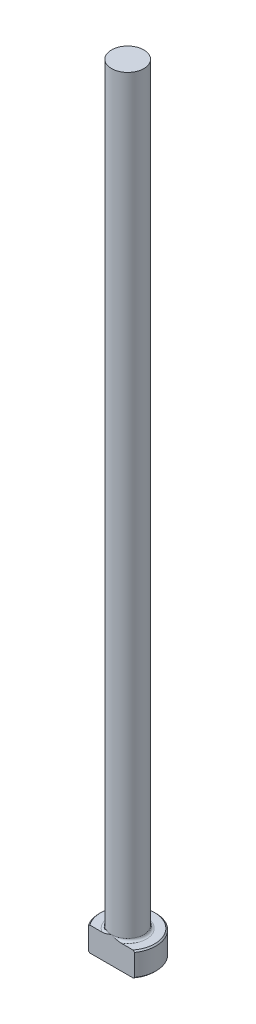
SolidWorks part; units mm, degrees
ref_plane "Front Plane" through (0, 0, 0) normal (0, 0, 1) x (1, 0, 0)
ref_plane "Top Plane" through (0, 0, 0) normal (0, 1, 0) x (1, 0, 0)
ref_plane "Right Plane" through (0, 0, 0) normal (1, 0, 0) x (0, 0, -1)
sketch "Sketch1" plane through (0, 0, 0) normal (0, 0, 1) x (1, 0, 0)
  line L0 (0, 259.9588) -> (0, -15.1925) construction
  line L1 (0, 0) -> (-5.5499, 0)
  line L2 (-5.5499, 0) -> (-5.5499, 4.7498)
  line L3 (-5.5499, 4.7498) -> (-3.175, 4.7498)
  line L4 (-3.175, 4.7498) -> (-3.175, 152.4)
  line L5 (-3.175, 152.4) -> (0, 152.4)
  line L6 (0, 152.4) -> (0, 0)
  dimension "L" = 152.4
  dimension "H" = 11.0998
  dimension "T" = 4.7498
  dimension "D" = 6.35
revolve "Revolve1" add sketch "Sketch1" angle 360 about L0
chamfer "Chamfer1" distance 0.254 angle 45 2 edges at (0, 4.7498, 5.5499) (0, 0, 5.5499)
fillet "Fillet1" radius 0.508 1 edges at (0, 4.7498, 3.175)
sketch "Sketch2" plane through (0, 0, 0) normal (0, 1, 0) x (1, 0, 0)
  line L0 (-4.552, -3.175) -> (4.552, -3.175)
  circle A0 centre (0, 0) radius 5.5499 construction
  arc A1 (-4.552, -3.175) -> (4.552, -3.175) centre (0, 0) ccw
  circle A3 centre (0, 0) radius 3.175 construction
  dimension "D1" = 0
extrude "Key" cut sketch "Sketch2" along normal through all
sketch "Pocket Sketch" plane through (0, 0, 0) normal (0, 0, 1) x (1, 0, 0)
  line L0 (-5.9468, 0) -> (-5.9468, 4.7752)
  line L1 (-5.9468, 4.7752) -> (-4.3339, 4.7752)
  line L2 (-3.5719, 5.5372) -> (-3.5719, 22.225)
  line L3 (-3.5719, 22.225) -> (0, 22.225)
  line L4 (0, 22.225) -> (0, 0)
  line L5 (0, 0) -> (-5.9468, 0)
  line L6 (0, 12.6104) -> (0, -2.4989) construction
  line L7 (-5.5499, 4.4958) -> (-5.5499, 0.254) construction
  line L8 (5.2959, 4.7498) -> (-5.2959, 4.7498) construction
  line L9 (-3.175, 152.4) -> (-3.175, 5.2578) construction
  line L10 (-4.3339, 4.7752) -> (-3.5719, 5.5372)
  point P3 (-3.5719, 4.7752)
  dimension "D1" = 11.8935
  dimension "D2" = 0.3969
  dimension "D3" = 0.0254
  dimension "D4" = 0.3969
  dimension "D5" = 7.1437
  dimension "D6" = 22.225
